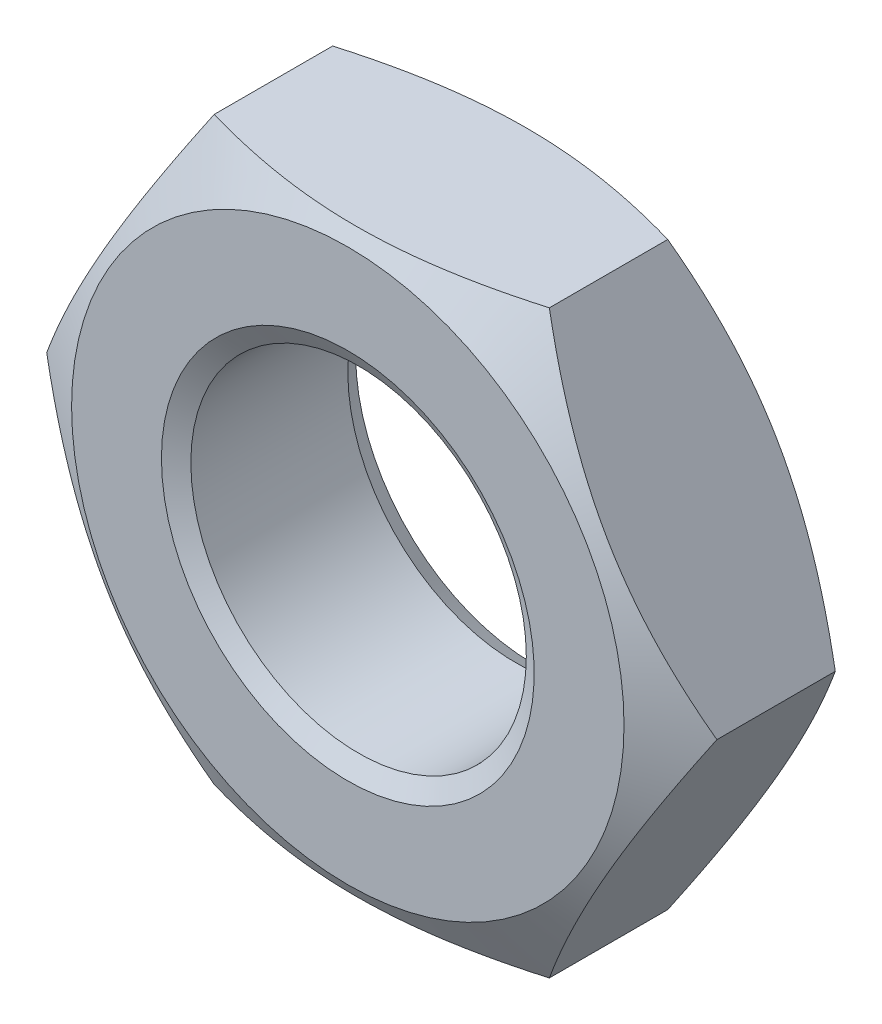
SolidWorks part; units mm, degrees
ref_plane "Front" through (0, 0, 0) normal (0, 0, 1) x (1, 0, 0)
ref_plane "Top" through (0, 0, 0) normal (0, 1, 0) x (1, 0, 0)
ref_plane "Right" through (0, 0, 0) normal (1, 0, 0) x (0, 0, -1)
sketch "Sketch1" plane through (0, 0, 0) normal (0, 0, 1) x (1, 0, 0)
  line L1 (4.4947, -7.785) -> (8.9893, 0)
  line L2 (8.9893, 0) -> (4.4947, 7.785)
  line L3 (4.4947, 7.785) -> (-4.4947, 7.785)
  line L4 (-4.4947, 7.785) -> (-8.9893, 0)
  line L5 (-8.9893, 0) -> (-4.4947, -7.785)
  line L6 (-4.4947, -7.785) -> (4.4947, -7.785)
  circle A0 centre (0, 0) radius 7.785 construction
  circle A1 centre (0, 0) radius 4.5
  dimension "D" = 9
  dimension "s" = 15.57
extrude "BaseNut" add sketch "Sketch1" against normal blind 5
sketch "Sketch2" plane through (0, 0, 0) normal (0, 1, 0) x (1, 0, 0)
  line L0 (-8.9893, 5) -> (-7.41, 5)
  line L2 (-7.41, 5) -> (-8.9893, 4.0882)
  line L3 (-8.9893, 4.0882) -> (-8.9893, 5)
  line L4 (0, 3.3759) -> (0, -9.8171) construction
  line L6 (-9.7712, 2.5) -> (9.8853, 2.5) construction
  line L7 (-8.9893, 0.9118) -> (-8.9893, 0)
  line L8 (-7.41, 0) -> (-8.9893, 0.9118)
  line L9 (-8.9893, 0) -> (-7.41, 0)
  dimension "D1" = 30
  dimension "dw" = 14.82
  dimension "D2" = 2.5
revolve "Double-Chamfer" cut sketch "Sketch2" angle 360 about L4
chamfer "EndChamfer" distance 0.5 angle 30 2 edges at (4.5, 0, -5) (4.5, 0, 0)
sketch "Sketch3" plane through (0, 0, 0) normal (0, 1, 0) x (1, 0, 0)
  line L0 (4, 4.75) -> (4.5, 4.75)
  line L1 (4.5, 4.75) -> (4.933, 4.5)
  line L2 (4.933, 4.5) -> (4.5, 4.25)
  line L3 (4.5, 4.25) -> (4, 4.25)
  line L4 (4, 4.25) -> (4, 4.75)
  line L5 (0, 7.3697) -> (0, -1.2922) construction
  line L6 (4.5, 4.5) -> (-4.5, 4.5) construction
  dimension "D1" = 0.5
  dimension "D2" = 9
revolve "Cut-Revolve10" [suppressed] cut sketch "Sketch3" angle 360 about L5
pattern_linear "LPattern10" [suppressed] count 8 spacing 0.6 along (0, 0, 1)
equation "\"dw@Sketch2\" = \"s@Sketch1\"-0.75"
equation "\"D1@EndChamfer\" = \"m@BaseNut\" / 10"
equation "\"D2@Sketch2\" = \"m@BaseNut\" / 2"
equation "\"D2@Sketch3\" = \"D@Sketch1\""
equation "\"D1@Sketch3\" = (  \"D@ThreadCosmetic1\" - \"D@Sketch1\" )  / 2"
equation "\"D3@LPattern10\" = \"D1@Sketch3\" * 1.2"
equation "\"D1@LPattern10\" =  ( \"m@BaseNut\"   - \"D1@EndChamfer\")  / \"D3@LPattern10\" "
